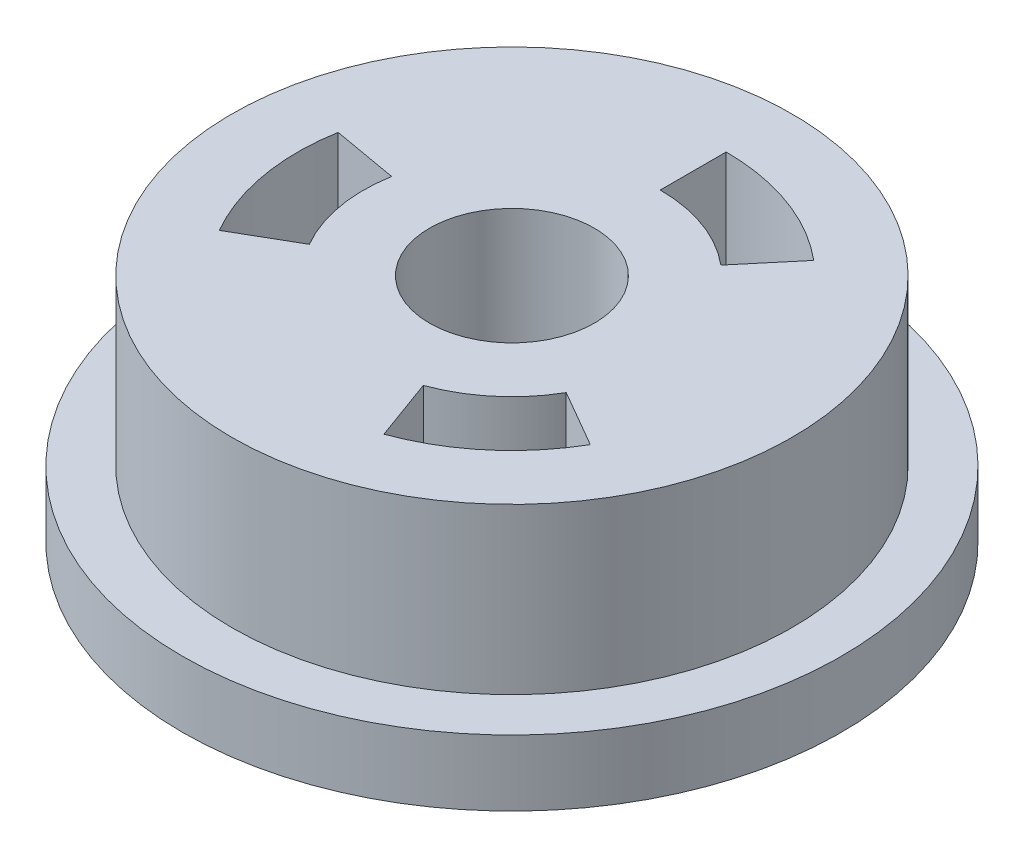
SolidWorks part; units mm, degrees
ref_plane "前视基准面" through (0, 0, 0) normal (0, 0, 1) x (1, 0, 0)
ref_plane "上视基准面" through (0, 0, 0) normal (0, 1, 0) x (1, 0, 0)
ref_plane "右视基准面" through (0, 0, 0) normal (1, 0, 0) x (0, 0, -1)
sketch "草图1" plane through (0, 0, 0) normal (0, 1, 0) x (1, 0, 0)
  circle A0 centre (0, 0) radius 10
  dimension "D1" = 20
extrude "凸台-拉伸2" add sketch "草图1" against normal blind 2
sketch "草图2" plane through (0, 0, 0) normal (0, 1, 0) x (1, 0, 0)
  circle A0 centre (0, 0) radius 8.5
  dimension "D1" = 17
extrude "凸台-拉伸3" add sketch "草图2" along normal blind 5
sketch "草图3" plane through (0, 5, 0) normal (0, 1, 0) x (1, 0, 0)
  line L0 (0, 4.5) -> (0, 6.5)
  line L1 (2.8925, 3.4472) -> (4.1781, 4.9793)
  circle A0 centre (0, 0) radius 5.5 construction
  circle A1 centre (0, 0) radius 4.5
  circle A2 centre (0, 0) radius 6.5
  dimension "D1" = 11
  dimension "D2" = 9
  dimension "D3" = 13
  dimension "D4" = 40
extrude "切除-拉伸1" cut sketch "草图3" against normal blind 3 contours L1 A2 L0 A1
pattern_circular "阵列(圆周)3" count 3 every 120 about axis through (0, 0, 0) along (0, 1, 0) of "切除-拉伸1"
sketch "草图4" plane through (0, 5, 0) normal (0, 1, 0) x (1, 0, 0)
  circle A0 centre (0, 0) radius 2.5
  dimension "D1" = 5
extrude "切除-拉伸2" cut sketch "草图4" against normal through all
